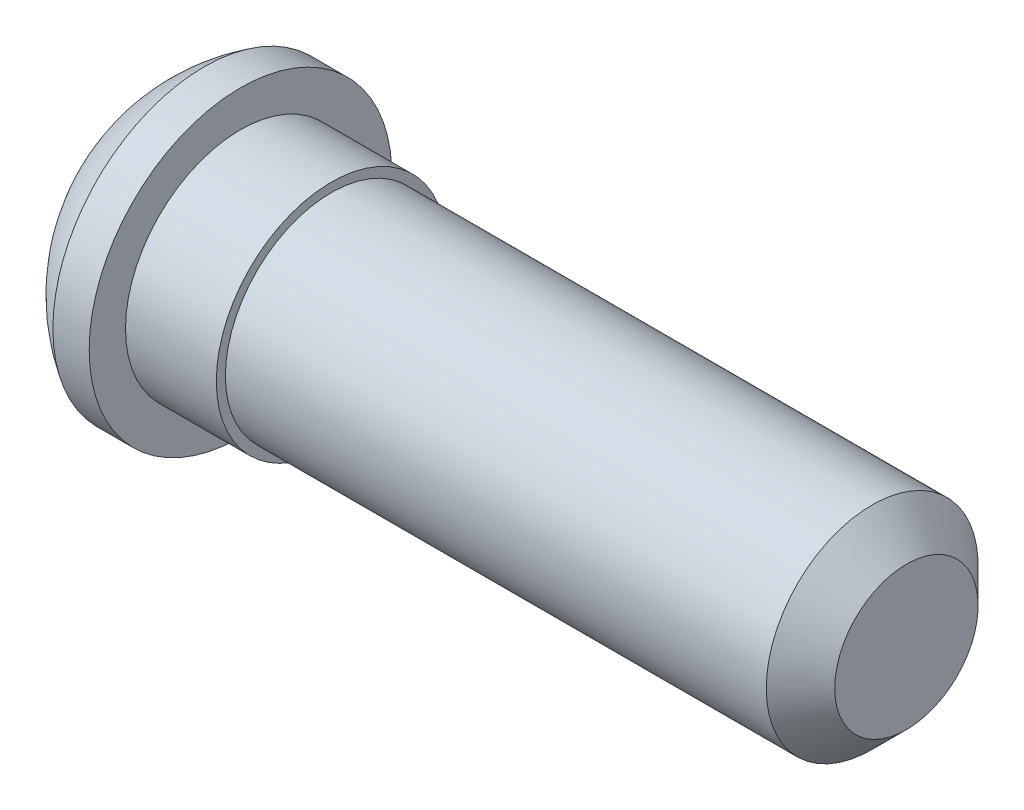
SolidWorks part; units mm, degrees
ref_plane "Front" through (0, 0, 0) normal (0, 0, 1) x (1, 0, 0)
ref_plane "Top" through (0, 0, 0) normal (0, 1, 0) x (1, 0, 0)
ref_plane "Right" through (0, 0, 0) normal (1, 0, 0) x (0, 0, -1)
sketch "Sketch1" plane through (0, 0, 0) normal (0, 0, 1) x (1, 0, 0)
  line L0 (-46.8623, 0) -> (116.3428, 0) construction
  line L2 (4.445, 7.9375) -> (6.35, 7.9375)
  line L3 (6.35, 7.9375) -> (6.35, 6.0325)
  line L4 (6.35, 6.0325) -> (11.1125, 6.0325)
  line L5 (11.1125, 6.0325) -> (11.1125, 5.5562)
  line L6 (11.1125, 5.5562) -> (39.4789, 5.5563)
  line L7 (39.4789, 5.5563) -> (41.275, 3.7602)
  line L8 (41.275, 3.7602) -> (41.275, 0)
  line L9 (41.275, 0) -> (0, 0)
  arc A0 (0, 0) -> (4.445, 7.9375) centre (9.3096, 0) cw
  dimension "D9" = 1.905
  dimension "D1" = 15.875
  dimension "D2" = 45
  dimension "D3" = 11.1125
  dimension "D4" = 12.065
  dimension "D5" = 6.35
  dimension "D6" = 4.7625
  dimension "D7" = 34.925
  dimension "D8" = 2.54
revolve "Revolve1" add sketch "Sketch1" angle 360 about L0
